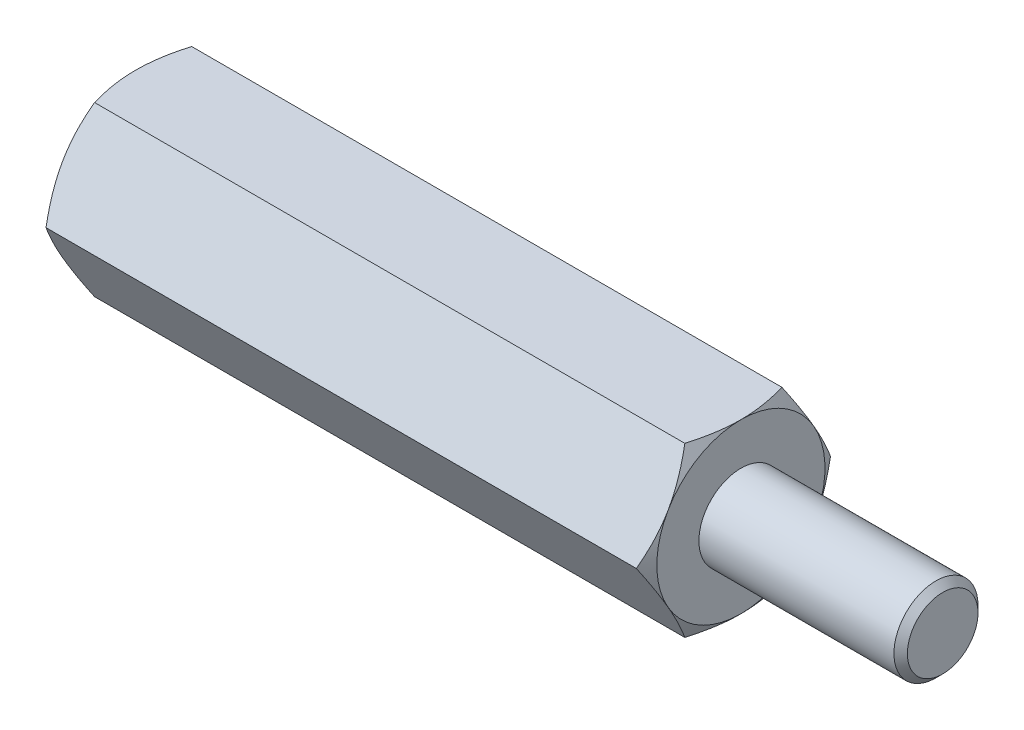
SolidWorks part; units mm, degrees
ref_plane "Front Plane" through (0, 0, 0) normal (0, 0, 1) x (1, 0, 0)
ref_plane "Top Plane" through (0, 0, 0) normal (0, 1, 0) x (1, 0, 0)
ref_plane "Right Plane" through (0, 0, 0) normal (1, 0, 0) x (0, 0, -1)
sketch "Sketch1" plane through (0, 0, 0) normal (1, 0, 0) x (0, 0, -1)
  line L1 (1.4434, 2.5) -> (-1.4434, 2.5)
  line L2 (-1.4434, 2.5) -> (-2.8868, 0)
  line L3 (-2.8868, 0) -> (-1.4434, -2.5)
  line L4 (-1.4434, -2.5) -> (1.4434, -2.5)
  line L5 (1.4434, -2.5) -> (2.8868, 0)
  line L6 (2.8868, 0) -> (1.4434, 2.5)
  circle A0 centre (0, 0) radius 2.5 construction
  dimension "D1" = 5
extrude "Extrude2" add sketch "Sketch1" along normal mid plane 18
sketch "Sketch2" plane through (0, 0, 0) normal (0, 0, 1) x (1, 0, 0)
  line L0 (-9, 2.5) -> (-7.5, 5.0981)
  line L1 (-9, 5.5) -> (-9, 2.5)
  line L3 (0, 0) -> (50000, 0) construction
  arc A0 (-7.5, 5.0981) -> (-9, 5.5) centre (-8.1962, 5.5) ccw
  dimension "D1" = 30
  dimension "D2" = 3
revolve "Cut-Revolve1" cut sketch "Sketch2" angle 360 about L3
mirror "Mirror1" about plane through (0, 0, 0) normal (1, 0, 0) of "Cut-Revolve1"
sketch "Sketch3" plane through (-9, 0, 0) normal (-1, 0, 0) x (0, 0, 1)
  circle A0 centre (0, 0) radius 1.05
  dimension "D1" = 2.1
extrude "Extrude3" cut sketch "Sketch3" against normal blind 6
sketch "Sketch4" plane through (0, 0, 0) normal (0, 0, 1) x (1, 0, 0)
  line L0 (-3, 0) -> (-3, 1.05)
  line L1 (8.7767, 0) -> (-8.7767, 0) construction
  line L2 (-3, 1.05) -> (-2.3938, 0)
  line L3 (-2.3938, 0) -> (-3, 0)
  line L4 (-9, 1.25) -> (-9, -1.25) construction
  point P4 (-9, 0)
  dimension "D1" = 30
  dimension "D2" = 1.05
  dimension "D3" = 6
revolve "Cut-Revolve2" cut sketch "Sketch4" angle 360 about L3
sketch "Sketch5" plane through (9, 0, 0) normal (1, 0, 0) x (0, 0, -1)
  circle A0 centre (0, 0) radius 1.25
  dimension "D1" = 2.5
extrude "Extrude4" add sketch "Sketch5" along normal blind 6
chamfer "Chamfer1" distance 0.2 angle 45 1 edges at (15, 0, -1.25)
equation "\"D2@Sketch4\" = \"D1@Sketch3\"/2"
